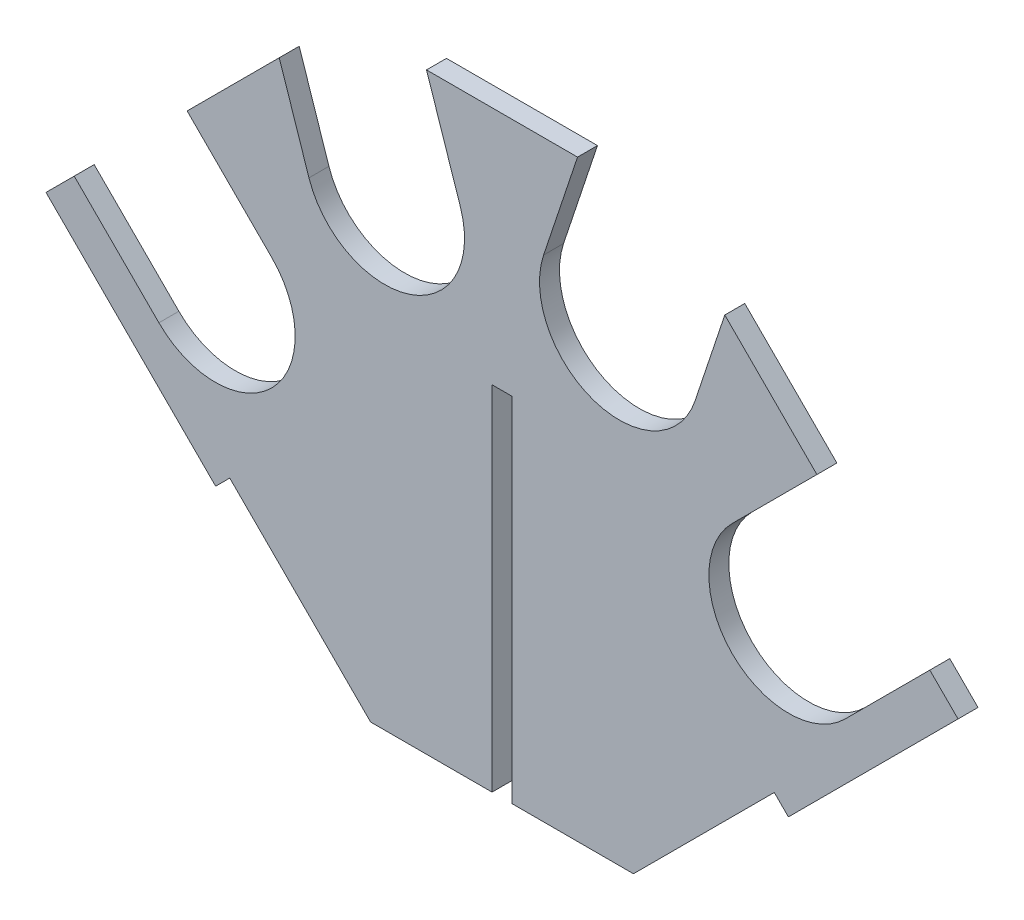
SolidWorks part; units mm, degrees
ref_plane "Front Plane" through (0, 0, 0) normal (0, 0, 1) x (1, 0, 0)
ref_plane "Top Plane" through (0, 0, 0) normal (0, 1, 0) x (1, 0, 0)
ref_plane "Right Plane" through (0, 0, 0) normal (1, 0, 0) x (0, 0, -1)
sketch "Sketch1" plane through (0, 0, 0) normal (0, 0, 1) x (1, 0, 0)
  line L0 (182.2354, 182.2354) -> (290.1854, 290.1854) construction
  line L1 (-182.2354, 182.2354) -> (-290.1854, 290.1854) construction
  line L2 (-6.35, 326.1064) -> (6.35, 326.1064) construction
  line L3 (182.2354, 182.2354) -> (290.1854, 290.1854)
  line L4 (-182.2354, 182.2354) -> (-290.1854, 290.1854)
  line L5 (-6.35, 326.1064) -> (6.35, 326.1064)
  line L6 (101.6, 478.7708) -> (290.1854, 290.1854) construction
  line L7 (-101.6, 478.7708) -> (101.6, 478.7708) construction
  line L8 (-101.6, 478.7708) -> (-290.1854, 290.1854) construction
  line L9 (101.6, 478.7708) -> (290.1854, 290.1854)
  line L10 (-101.6, 478.7708) -> (101.6, 478.7708)
  line L11 (-101.6, 478.7708) -> (-290.1854, 290.1854)
  line L12 (-6.35, 785.3759) -> (-6.35, 101.6) construction
  line L13 (6.35, 785.3759) -> (6.35, 101.6) construction
  line L14 (-6.35, 326.1064) -> (-6.35, 101.6)
  line L15 (6.35, 326.1064) -> (6.35, 101.6)
  line L17 (498.0077, 515.9682) -> (14.5051, 32.4656) construction
  line L18 (-101.6, 101.6) -> (101.6, 101.6) construction
  line L19 (173.2551, 191.2156) -> (83.6395, 101.6)
  line L20 (-182.2354, 182.2354) -> (-173.2551, 191.2156) construction
  line L21 (173.2551, 191.2156) -> (182.2354, 182.2354) construction
  line L22 (-182.2354, 182.2354) -> (-173.2551, 191.2156)
  line L23 (173.2551, 191.2156) -> (182.2354, 182.2354)
  line L24 (-498.0077, 515.9682) -> (-14.5051, 32.4656) construction
  line L25 (-83.6395, 101.6) -> (-6.35, 101.6)
  line L27 (-173.2551, 191.2156) -> (-83.6395, 101.6)
  line L28 (6.35, 101.6) -> (83.6395, 101.6)
  circle A0 centre (182.4223, 290.1854) radius 50.8 construction
  circle A1 centre (74.6592, 397.9485) radius 50.8 construction
  circle A2 centre (-74.6592, 397.9485) radius 50.8 construction
  circle A3 centre (-182.4223, 290.1854) radius 50.8 construction
  circle A4 centre (182.4223, 290.1854) radius 50.8
  circle A5 centre (74.6592, 397.9485) radius 50.8
  circle A6 centre (-74.6592, 397.9485) radius 50.8
  circle A7 centre (-182.4223, 290.1854) radius 50.8
extrude "Extrude1" add sketch "Sketch1" along normal blind 12.7
sketch "Sketch2" plane through (0, 0, 12.7) normal (0, 0, 1) x (1, 0, 0)
  line L0 (272.2249, 308.1459) -> (218.3433, 254.2644)
  line L1 (200.3828, 379.9879) -> (146.5013, 326.1064)
  line L2 (141.7609, 438.6098) -> (122.8523, 381.8841)
  line L3 (101.6, 478.7708) -> (-101.6, 478.7708) construction
  line L4 (48.0521, 478.7708) -> (26.4661, 414.0128)
  line L6 (-48.0521, 478.7708) -> (-26.4661, 414.0128)
  line L7 (-141.7609, 438.6098) -> (-122.8523, 381.8841)
  line L8 (-200.3828, 379.9879) -> (-146.5013, 326.1064)
  line L9 (-272.2249, 308.1459) -> (-218.3433, 254.2644)
  line L10 (-101.6, 478.7708) -> (-290.1854, 290.1854) construction
  line L11 (290.1854, 290.1854) -> (101.6, 478.7708) construction
  line L12 (101.6, 478.7708) -> (48.0521, 478.7708)
  line L13 (-101.6, 478.7708) -> (-141.7609, 438.6098)
  line L14 (272.2249, 308.1459) -> (200.3828, 379.9879)
  line L15 (-74.6592, 397.9485) -> (-101.6, 478.7708) construction
  line L16 (101.6, 478.7708) -> (74.6592, 397.9485) construction
  line L17 (141.7609, 438.6098) -> (101.6, 478.7708)
  line L18 (-48.0521, 478.7708) -> (-101.6, 478.7708)
  line L19 (-200.3828, 379.9879) -> (-272.2249, 308.1459)
  circle A0 centre (182.4223, 290.1854) radius 50.8 construction
  circle A1 centre (74.6592, 397.9485) radius 50.8 construction
  circle A2 centre (-74.6592, 397.9485) radius 50.8 construction
  circle A3 centre (-182.4223, 290.1854) radius 50.8 construction
  arc A4 (-146.5013, 326.1064) -> (-218.3433, 254.2644) centre (-182.4223, 290.1854) ccw
  arc A5 (-26.4661, 414.0128) -> (-122.8523, 381.8841) centre (-74.6592, 397.9485) ccw
  arc A6 (122.8523, 381.8841) -> (26.4661, 414.0128) centre (74.6592, 397.9485) ccw
  arc A7 (218.3433, 254.2644) -> (146.5013, 326.1064) centre (182.4223, 290.1854) ccw
extrude "Cut-Extrude1" cut sketch "Sketch2" against normal up to next
